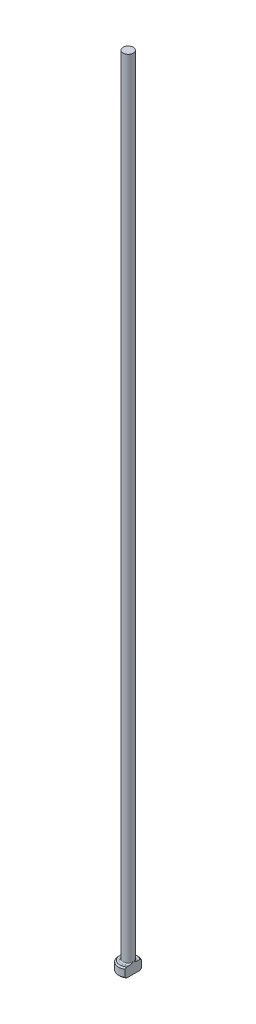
SolidWorks part; units mm, degrees
ref_plane "Front Plane" through (0, 0, 0) normal (0, 0, 1) x (1, 0, 0)
ref_plane "Top Plane" through (0, 0, 0) normal (0, 1, 0) x (1, 0, 0)
ref_plane "Right Plane" through (0, 0, 0) normal (1, 0, 0) x (0, 0, -1)
sketch "Sketch1" plane through (0, 0, 0) normal (0, 0, 1) x (1, 0, 0)
  line L0 (0, 259.9588) -> (0, -15.1925) construction
  line L1 (0, 0) -> (-1.5, 0)
  line L2 (-1.5, 0) -> (-1.5, 1.5)
  line L3 (-1.5, 1.5) -> (-0.8, 1.5)
  line L4 (-0.8, 1.5) -> (-0.8, 125)
  line L5 (-0.8, 125) -> (0, 125)
  line L6 (0, 125) -> (0, 0)
  dimension "L" = 125
  dimension "H" = 3
  dimension "T" = 1.5
  dimension "D" = 1.6
revolve "Revolve1" add sketch "Sketch1" angle 360 about L0
chamfer "Chamfer1" distance 0.2 angle 45 2 edges at (0, 1.5, 1.5) (0, 0, 1.5)
fillet "Fillet1" radius 0.2 1 edges at (0, 1.5, 0.8)
sketch "Sketch2" plane through (0, 0, 0) normal (0, 1, 0) x (1, 0, 0)
  line L0 (0.8, 1.2689) -> (0.8, -1.2689)
  circle A0 centre (0, 0) radius 1.5 construction
  arc A1 (0.8, -1.2689) -> (0.8, 1.2689) centre (0, 0) ccw
  circle A2 centre (0, 0) radius 0.8 construction
extrude "KEY" cut sketch "Sketch2" along normal through all
